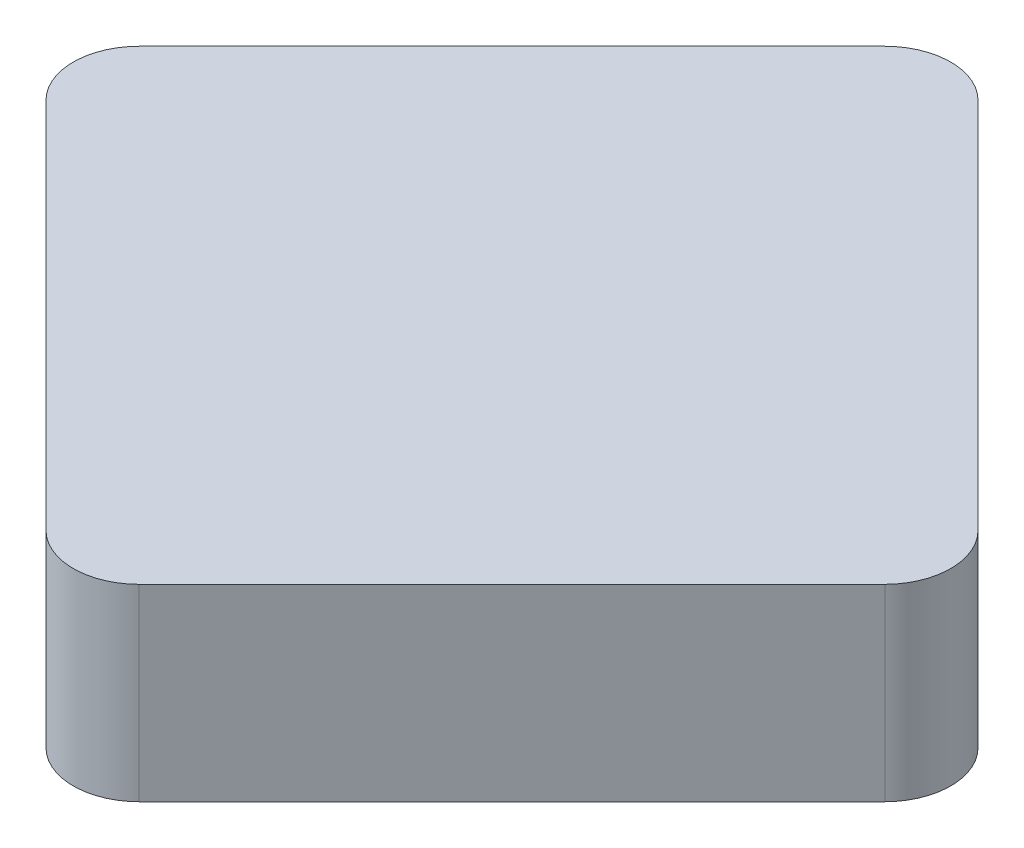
SolidWorks part; units mm, degrees
ref_plane "Face" through (0, 0, 0) normal (0, 0, 1) x (1, 0, 0)
ref_plane "Dessus" through (0, 0, 0) normal (0, 1, 0) x (1, 0, 0)
ref_plane "Droite" through (0, 0, 0) normal (1, 0, 0) x (0, 0, -1)
sketch "EsqCorps" plane through (0, 0, 0) normal (0, 1, 0) x (1, 0, 0)
  circle A0 centre (0, 0) radius 0.0005
  dimension "Dcorps" = 0.001
extrude "Corps" add sketch "EsqCorps" against normal mid plane 0.001
sketch "EsqC" plane through (0, 0, 0) normal (0, 1, 0) x (1, 0, 0)
  line L0 (-0.8485, -0.8485) -> (5.9397, -7.6368)
  line L1 (7.6368, -7.6368) -> (14.425, -0.8485)
  line L2 (14.425, 0.8485) -> (7.6368, 7.6368)
  line L3 (5.9397, 7.6368) -> (-0.8485, 0.8485)
  line L4 (-0.8485, 0.8485) -> (-0.8485, 0.9485) construction
  arc A0 (-0.8485, 0.8485) -> (-0.8485, -0.8485) centre (0, 0) ccw
  arc A1 (7.6368, 7.6368) -> (5.9397, 7.6368) centre (6.7882, 6.7882) ccw
  arc A2 (14.425, -0.8485) -> (14.425, 0.8485) centre (13.5765, 0) ccw
  arc A3 (5.9397, -7.6368) -> (7.6368, -7.6368) centre (6.7882, -6.7882) ccw
  dimension "RayonBec" = 1.2
  dimension "Kr" = 45
  dimension "AnglePlaquette" = 90
  dimension "DimPlaquette" = 9.6
extrude "PlaquetteC" add sketch "EsqC" against normal blind 3.4286
sketch "EsqT" [suppressed] plane through (0, 0, 0) normal (0, 1, 0) x (1, 0, 0)
  line L0 (0.0009, 0.0003) -> (5.1306, -14.0932)
  line L1 (5.1294, -14.0945) -> (-9.6407, -11.4901)
  line L2 (-9.6413, -11.4885) -> (-0.0008, 0.0006)
  line L3 (0.0009, 0.0003) -> (0.0009, 0.1003) construction
  arc A0 (0.0009, 0.0003) -> (-0.0008, 0.0006) centre (0, 0) ccw
  arc A1 (5.1294, -14.0945) -> (5.1306, -14.0932) centre (5.1296, -14.0935) ccw
  arc A2 (-9.6413, -11.4885) -> (-9.6407, -11.4901) centre (-9.6405, -11.4891) ccw
  dimension "RayonBec" = 1
  dimension "Kr" = 95
  dimension "AnglePlaquette" = 60
  dimension "D4" = 60
  dimension "DimPlaquette" = 8
extrude "PlaquetteT" [suppressed] add sketch "EsqT" against normal blind 4
sketch "EsqW" plane through (0, 0, 0) normal (0, 1, 0) x (1, 0, 0)
  line L0 (0.0872, 0.9962) -> (6.0643, 0.4733)
  line L1 (6.0643, 0.4733) -> (11.5022, -2.0624)
  line L2 (11.8987, -3.5423) -> (8.4572, -8.4572)
  line L3 (8.4572, -8.4572) -> (3.5423, -11.8987)
  line L4 (2.0624, -11.5022) -> (-0.4733, -6.0643)
  line L5 (-0.4733, -6.0643) -> (-0.9962, -0.0872)
  line L6 (0.0872, 0.9962) -> (0.0872, 1.0962) construction
  arc A0 (0.0872, 0.9962) -> (-0.9962, -0.0872) centre (0, 0) ccw
  arc A1 (3.5423, -11.8987) -> (2.0624, -11.5022) centre (2.9688, -11.0796) cw
  arc A2 (11.5022, -2.0624) -> (11.8987, -3.5423) centre (11.0796, -2.9688) cw
  dimension "RayonBec" = 1
  dimension "AnglePlaquette" = 80
  dimension "D2" = 80
  dimension "D3" = 80
  dimension "D4" = 160
  dimension "D5" = 160
  dimension "DimPlaquette" = 6
  dimension "Kr" = 95
extrude "PlaquetteW" [suppressed] add sketch "EsqW" along normal blind 4
sketch "EsqR" [suppressed] plane through (0, 0, 0) normal (0, 1, 0) x (1, 0, 0)
  circle A0 centre (0, 0) radius 6
  dimension "Diametre" = 12
extrude "PlaquetteR" [suppressed] add sketch "EsqR" against normal blind 4
sketch "EsqK" [suppressed] plane through (0, 0, 0) normal (0, 1, 0) x (1, 0, 0)
  line L0 (0.0872, 0.9962) -> (1.0834, 0.909)
  line L1 (-0.866, -0.5) -> (0.134, -2.2321)
  line L2 (1.8622, 0.4128) -> (2.8622, -1.3192)
  line L3 (1.909, -2.8154) -> (0.9128, -2.7282)
  line L4 (0.0872, 0.9962) -> (0.0872, 1.0962) construction
  arc A0 (0.0872, 0.9962) -> (-0.866, -0.5) centre (0, 0) ccw
  arc A1 (1.8622, 0.4128) -> (1.0834, 0.909) centre (0.9962, -0.0872) ccw
  arc A2 (1.909, -2.8154) -> (2.8622, -1.3192) centre (1.9962, -1.8192) ccw
  arc A3 (0.134, -2.2321) -> (0.9128, -2.7282) centre (1, -1.7321) ccw
  dimension "RayonBec" = 1
  dimension "Kr" = 95
  dimension "DimPlaquette1" = 0
  dimension "AnglePlaquette" = 55
  dimension "DimPlaquette2" = 0
extrude "PlaquetteK" [suppressed] add sketch "EsqK" against normal blind 4
sketch "EsqGR" [suppressed] plane through (0, 0, 0) normal (0, 1, 0) x (1, 0, 0)
  line L0 (1.4283, 1.4) -> (6, 1.4)
  line L1 (6, 1.4) -> (6, -1.4)
  line L2 (6, -1.4) -> (1.4283, -1.4)
  line L3 (1.4283, 1.4) -> (1.4283, 1.5) construction
  arc A0 (1.4283, 1.4) -> (1.4283, -1.4) centre (0, 0) ccw
  dimension "RayonBec" = 2
  dimension "Largeur" = 2.8
  dimension "Longueur" = 6
  dimension "Kr" = 90
extrude "PlaquetteGR" [suppressed] add sketch "EsqGR" against normal blind 4
sketch "EsqGP" plane through (0, 0, 0) normal (0, 1, 0) x (1, 0, 0)
  line L0 (0.1008, 0.9949) -> (4, 0.6)
  line L1 (4, 0.6) -> (9, 0.6)
  line L2 (9, 0.6) -> (9, -2.6)
  line L3 (9, -2.6) -> (4, -2.6)
  line L4 (4, -2.6) -> (0.1008, -2.9949)
  line L5 (-1, -2) -> (-1, 0)
  line L6 (4, 0.6) -> (4, 0.7) construction
  arc A0 (-1, 0) -> (0.1008, 0.9949) centre (0, 0) cw
  arc A1 (0.1008, -2.9949) -> (-1, -2) centre (0, -2) cw
  dimension "RayonBec" = 1
  dimension "RayonBec2" = 1
  dimension "Largeur" = 3.2
  dimension "Longueur" = 10
  dimension "LongCorps" = 5
  dimension "DimPlaquette" = 2
  dimension "PosCorps" = 2.6
  dimension "Kr" = 90
extrude "PlaquetteGP" [suppressed] add sketch "EsqGP" against normal blind 4
sketch "EsqGFT1" [suppressed] plane through (0, 0, 0) normal (0, 1, 0) x (1, 0, 0)
  line L0 (-0.0436, 0.4981) -> (1.7102, 0.6515)
  line L1 (2.1667, 1.1496) -> (2.1667, 1.4582)
  line L2 (2.1667, 1.4582) -> (10.6667, 1.4582)
  line L3 (10.6667, 1.4582) -> (14.1667, -2.0418)
  line L4 (14.1667, -2.0418) -> (14.1667, -5.6504)
  line L5 (14.6231, -6.1485) -> (16.3769, -6.3019)
  line L6 (16.8333, -6.8) -> (16.8333, -9.0837)
  line L7 (16.3769, -9.5818) -> (14.6231, -9.7352)
  line L8 (14.1667, -10.2333) -> (14.1667, -10.5418)
  line L9 (14.1667, -10.5418) -> (5.6667, -10.5418)
  line L10 (5.6667, -10.5418) -> (2.1667, -7.0418)
  line L11 (2.1667, -7.0418) -> (2.1667, -3.4333)
  line L12 (1.7102, -2.9352) -> (-0.0436, -2.7818)
  line L13 (-0.5, -2.2837) -> (-0.5, 0)
  line L14 (2.1667, 1.4582) -> (2.1667, 6.5976) construction
  circle A0 centre (8.1667, -4.5418) radius 2
  arc A1 (-0.0436, 0.4981) -> (-0.5, 0) centre (0, 0) ccw
  arc A2 (2.1667, 1.1496) -> (1.7102, 0.6515) centre (1.6667, 1.1496) cw
  arc A3 (-0.0436, -2.7818) -> (-0.5, -2.2837) centre (0, -2.2837) cw
  arc A4 (2.1667, -3.4333) -> (1.7102, -2.9352) centre (1.6667, -3.4333) ccw
  arc A5 (14.6231, -6.1485) -> (14.1667, -5.6504) centre (14.6667, -5.6504) cw
  arc A6 (16.8333, -6.8) -> (16.3769, -6.3019) centre (16.3333, -6.8) ccw
  arc A7 (16.3769, -9.5818) -> (16.8333, -9.0837) centre (16.3333, -9.0837) ccw
  arc A8 (14.1667, -10.2333) -> (14.6231, -9.7352) centre (14.6667, -10.2333) cw
  point P18 (-0.5, 0.4582)
  point P21 (2.1667, 0.6915)
  point P24 (-0.5, -2.7418)
  dimension "D1" = 95
  dimension "D11" = 4
  dimension "D12" = 6
  dimension "D13" = 6
  dimension "RayonBec" = 0.5
  dimension "D2" = 95
  dimension "D3" = 3.5
  dimension "Hauteur" = 2.6667
  dimension "DimPlaquette" = 3.2
  dimension "Position" = 1
  dimension "D6" = 135
  dimension "D7" = 12
  dimension "D8" = 12
  dimension "D9" = 135
  dimension "Kr" = 90
extrude "PlaquetteGFT1" [suppressed] add sketch "EsqGFT1" against normal blind 4.76
sketch "EsqFI1" plane through (0, 0, 0) normal (0, 1, 0) x (1, 0, 0)
  line L0 (0, 0) -> (1.5, 0.866)
  line L1 (1.5, 0.866) -> (7.5386, 0.866)
  line L2 (0, 0) -> (1.5, -0.866)
  line L3 (1.5, -0.866) -> (1.5, -5.1726)
  line L4 (1.5, -5.1726) -> (4.5193, -10.4022)
  line L5 (9.7489, -7.3829) -> (12.7682, -2.1533)
  line L6 (7.5386, 0.866) -> (11.2682, -1.2873)
  line L7 (12.7682, -0.4212) -> (11.2682, -1.2873)
  line L8 (12.7682, -0.4212) -> (12.7682, -2.1533)
  line L9 (11.2682, -1.2873) -> (7.5386, 0.866)
  line L10 (6.0193, -11.2682) -> (6.0193, -9.5361)
  line L11 (6.0193, -11.2682) -> (4.5193, -10.4022)
  line L12 (6.0193, -9.5361) -> (9.7489, -7.3829)
  line L13 (6.0193, -9.5361) -> (9.7489, -7.3829)
  line L14 (1.5, 0.866) -> (1.5, 4.3142) construction
  circle A0 centre (6.2625, -3.8965) radius 4.7625 construction
  circle A1 centre (6.2625, -3.8965) radius 1.9
  dimension "D6" = 60
  dimension "D11" = 3.8
  dimension "D7" = 9.525
  dimension "D1" = 60
  dimension "D2" = 1.5
  dimension "D4" = 150
  dimension "D5" = 60
  dimension "D9" = 150
  dimension "D10" = 150
  dimension "Kr" = 90
extrude "PlaquetteFI1" [suppressed] add sketch "EsqFI1" against normal blind 3.65
sketch "EsqGFCL" plane through (0, 0, 0) normal (0, 0, 1) x (1, 0, 0)
  line L0 (7.1798, -13.6703) -> (8.4782, -12.6558)
  line L1 (2.5, 0) -> (13.9009, 0)
  line L2 (14.1787, -2.7823) -> (8.4782, -12.6558)
  line L3 (5.9295, -11.5047) -> (0.2293, -1.6317)
  line L4 (0, 0) -> (0.2293, -1.6317)
  line L5 (15.4287, -0.6172) -> (13.9009, 0)
  line L6 (7.183, -13.6677) -> (8.4782, -12.6558)
  line L7 (0, 0) -> (0, 5.2766) construction
  line L9 (0, 0) -> (0, 0.0005) construction
  circle A0 centre (7.5362, -4.7625) radius 4.7625 construction
  circle A1 centre (7.5362, -4.7625) radius 2.25
  arc A2 (2.5, 0) -> (0, 0) centre (1.25, 2.1651) cw
  arc A3 (14.1787, -2.7823) -> (15.4287, -0.6172) centre (16.6787, -2.7823) cw
  arc A4 (7.183, -13.6677) -> (5.9295, -11.5047) centre (4.683, -13.6718) ccw
  arc A5 (5.9298, -11.5052) -> (7.1798, -13.6703) centre (4.6798, -13.6703) cw
  dimension "D1" = 60
  dimension "D3" = 9.525
  dimension "D4" = 4.5
  dimension "D8" = 2.5
  dimension "D11" = 2.5
  dimension "D10" = 2.5
  dimension "D2" = 60
  dimension "D5" = 6.8
  dimension "D6" = 158
  dimension "D7" = 2.5
  dimension "D9" = 158
  dimension "D12" = 6.8
  dimension "Kr" = 90
extrude "PlaquetteGFCL" [suppressed] add sketch "EsqGFCL" along normal blind 1.85
sketch "EsqGFCR" plane through (0, 0, 0) normal (0, 0, 1) x (1, 0, 0)
  line L0 (0, 0) -> (0, -6.7061) construction
  line L1 (14.1787, 2.7823) -> (8.4782, 12.6558)
  line L2 (5.9298, 11.5052) -> (0.2293, 1.6317)
  line L3 (0, 0) -> (0.2293, 1.6317)
  line L4 (15.4287, 0.6172) -> (13.9009, 0)
  line L5 (7.1798, 13.6703) -> (8.4782, 12.6558)
  line L6 (2.5, 0) -> (13.9009, 0)
  line L7 (0, 0) -> (0, 0.0005) construction
  circle A0 centre (7.5362, 4.7625) radius 4.7625 construction
  circle A1 centre (7.5362, 4.7625) radius 2.25
  arc A2 (2.5, 0) -> (0, 0) centre (1.25, -2.1651) ccw
  arc A3 (15.4287, 0.6172) -> (14.1787, 2.7823) centre (16.6787, 2.7823) cw
  arc A4 (7.1798, 13.6703) -> (5.9298, 11.5052) centre (4.6798, 13.6703) cw
  dimension "D1" = 9.525
  dimension "D4" = 4.5
  dimension "D8" = 2.5
  dimension "D12" = 2.5
  dimension "D14" = 2.5
  dimension "D5" = 158
  dimension "D6" = 6.8
  dimension "D7" = 2.5
  dimension "D9" = 158
  dimension "D11" = 2.5
  dimension "D13" = 2.5
  dimension "D15" = 6.8
  dimension "D16" = 6.8
  dimension "Kr" = 90
extrude "PlaquetteGFCR" [suppressed] add sketch "EsqGFCR" along normal blind 1.8
sketch "EsqGFT2" [suppressed] plane through (0, 0, 0) normal (0, 1, 0) x (1, 0, 0)
  line L0 (2.0833, -1.6842) -> (2.0833, 15.4983) construction
  line L14 (-0.5, 2.1837) -> (-0.5, 0)
  line L16 (1.6269, 2.8279) -> (-0.0436, 2.6818)
  line L17 (2.0833, 6.8158) -> (2.0833, 3.326)
  line L18 (5.5833, 10.3158) -> (2.0833, 6.8158)
  line L19 (14.0833, 10.3158) -> (5.5833, 10.3158)
  line L20 (14.0833, 9.774) -> (14.0833, 10.3158)
  line L21 (16.2102, 9.1297) -> (14.5398, 9.2759)
  line L22 (16.6667, 6.448) -> (16.6667, 8.6316)
  line L23 (14.5398, 5.8037) -> (16.2102, 5.9499)
  line L24 (14.0833, 1.8158) -> (14.0833, 5.3056)
  line L25 (10.5833, -1.6842) -> (14.0833, 1.8158)
  line L26 (2.0833, -1.6842) -> (10.5833, -1.6842)
  line L27 (2.0833, -1.1423) -> (2.0833, -1.6842)
  line L28 (-0.0436, -0.4981) -> (1.6269, -0.6442)
  arc A0 (2.0833, 3.326) -> (1.6269, 2.8279) centre (1.5833, 3.326) cw
  arc A1 (-0.5, 2.1837) -> (-0.0436, 2.6818) centre (0, 2.1837) cw
  arc A2 (-0.0436, -0.4981) -> (-0.5, 0) centre (0, 0) cw
  arc A3 (2.0833, -1.1423) -> (1.6269, -0.6442) centre (1.5833, -1.1423) ccw
  arc A4 (14.5398, 5.8037) -> (14.0833, 5.3056) centre (14.5833, 5.3056) ccw
  arc A5 (16.6667, 6.448) -> (16.2102, 5.9499) centre (16.1667, 6.448) cw
  arc A6 (16.6667, 8.6316) -> (16.2102, 9.1297) centre (16.1667, 8.6316) ccw
  arc A7 (14.5398, 9.2759) -> (14.0833, 9.774) centre (14.5833, 9.774) cw
  circle A17 centre (8.0833, 4.3158) radius 2
  point P5 (-0.5, 2.6418)
  point P9 (-0.5, -0.4582)
  point P13 (2.0833, -0.6842)
  point P26 (14.0833, 9.3158)
  dimension "D9" = 4
  dimension "RayonBec" = 0.5
  dimension "D1" = 12
  dimension "D2" = 12
  dimension "D3" = 135
  dimension "D4" = 135
  dimension "D5" = 3.5
  dimension "D6" = 3.5
  dimension "D7" = 6
  dimension "D8" = 6
  dimension "D10" = 95
  dimension "D11" = 95
  dimension "D12" = 1
  dimension "D13" = 95
  dimension "DimPlaquette" = 3.1
  dimension "D14" = 95
  dimension "D15" = 1
  dimension "Hauteur" = 2.5833
  dimension "Kr" = 90
extrude "PlaquetteGFT2" [suppressed] add sketch "EsqGFT2" along normal blind 4.76
sketch "EsqFI2" plane through (0, 0, 0) normal (0, 1, 0) x (1, 0, 0)
  line L0 (2.5, -1.4434) -> (2.5, 14.2883) construction
  line L1 (10.7489, 6.8055) -> (8.0193, 8.3814)
  line L2 (8.0193, 8.3814) -> (8.0193, 11.2682)
  line L3 (8.0193, 11.2682) -> (5.5193, 9.8248)
  line L4 (8.5386, -1.4434) -> (11.2682, 0.1326)
  line L5 (11.2682, 0.1326) -> (13.7682, -1.3108)
  line L22 (13.7682, -1.3108) -> (13.7682, 1.5759)
  line L25 (10.7489, 6.8055) -> (13.7682, 1.5759)
  line L26 (2.5, 4.5952) -> (5.5193, 9.8248)
  line L27 (2.5, 1.4434) -> (2.5, 4.5952)
  line L28 (0, 0) -> (2.5, 1.4434)
  line L29 (2.5, -1.4434) -> (8.5386, -1.4434)
  line L30 (0, 0) -> (2.5, -1.4434)
  circle A2 centre (7.2625, 3.3191) radius 4.7625 construction
  circle A3 centre (7.2625, 3.3191) radius 1.9
  dimension "D11" = 9.525
  dimension "D12" = 3.8
  dimension "D1" = 60
  dimension "D2" = 60
  dimension "D3" = 60
  dimension "D4" = 60
  dimension "D5" = 60
  dimension "D6" = 150
  dimension "D7" = 150
  dimension "D8" = 150
  dimension "D9" = 2.5
  dimension "Kr" = 90
extrude "PlaquetteFI2" [suppressed] add sketch "EsqFI2" along normal blind 3.65
equation "\"Largeur@EsqGR\" = 1.4 * \"RayonBec@EsqGR\""
equation "\"Longueur@EsqGR\" = 3 * \"RayonBec@EsqGR\""
equation "\"Largeur@EsqGP\" =  ( \"DimPlaquette@EsqGP\" + 2 * \"RayonBec@EsqGP\" )  * 0.8"
equation "\"Longueur@EsqGP\" = 2.5 *  ( \"DimPlaquette@EsqGP\" + 2 * \"RayonBec@EsqGP\" ) "
equation "\"PosCorps@EsqGP\" = \"DimPlaquette@EsqGP\" + \"RayonBec@EsqGP\" - (\"DimPlaquette@EsqGP\" + \"RayonBec@EsqGP\"*2) * 0.1"
equation "\"RayonBec2@EsqGP\" = \"RayonBec@EsqGP\""
equation "\"DimPlaquette2@EsqK\" = \"DimPlaquette1@EsqK\"/2"
equation "\"DimPlaquette1@EsqK\" = \"DimPlaquette2@EsqK\" /2"
equation "\"Hauteur@EsqGFT1\" = \"DimPlaquette@EsqGFT1\" / 1.2"
equation "\"Hauteur@EsqGFT2\" = \"DimPlaquette@EsqGFT2\" / 1.2"
equation "\"LongCorps@EsqGP\" = \"Longueur@EsqGP\" / 2"
